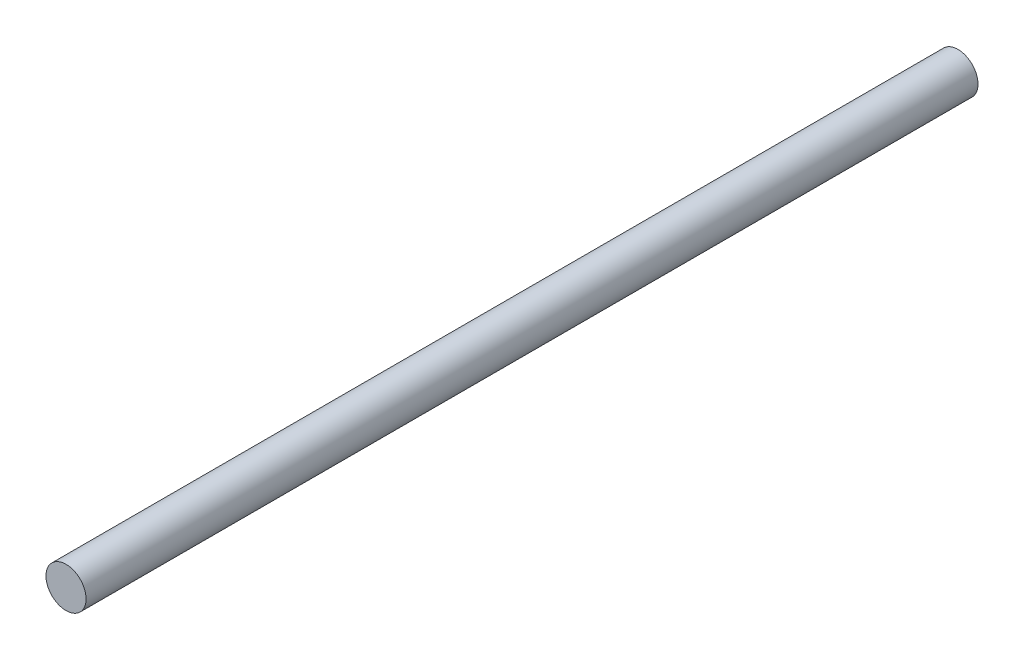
SolidWorks part; units mm, degrees
ref_plane "Front Plane" through (0, 0, 0) normal (0, 0, 1) x (1, 0, 0)
ref_plane "Top Plane" through (0, 0, 0) normal (0, 1, 0) x (1, 0, 0)
ref_plane "Right Plane" through (0, 0, 0) normal (1, 0, 0) x (0, 0, -1)
sketch "Sketch1" plane through (0, 0, 0) normal (0, 0, 1) x (1, 0, 0)
  circle A0 centre (0, 0) radius 3.025
extrude "Boss-Extrude1" add sketch "Sketch1" along normal blind 134.45
